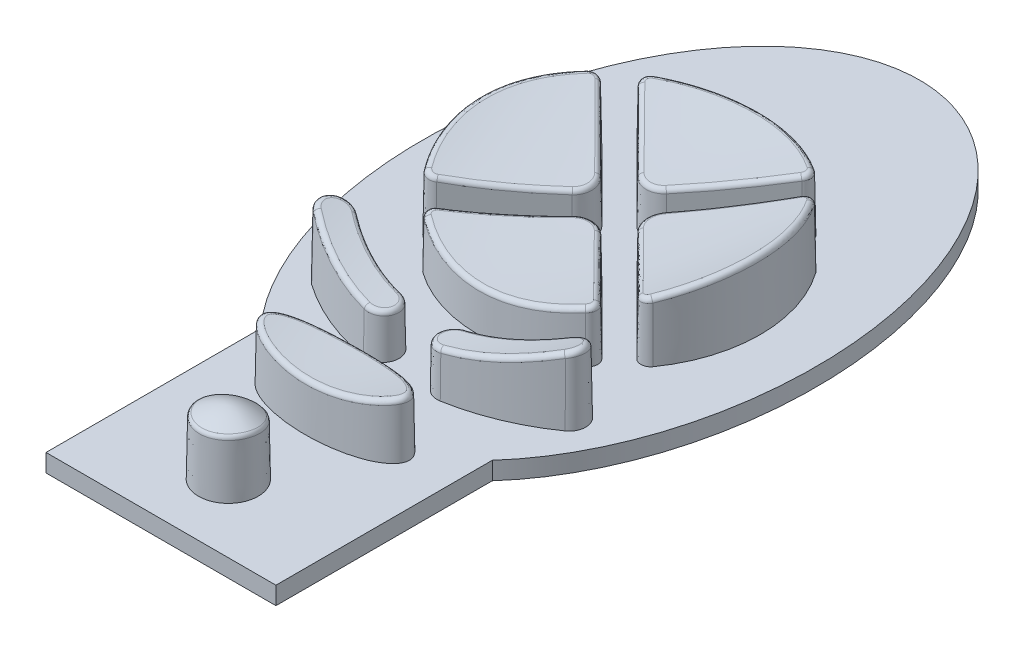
SolidWorks part; units mm, degrees
ref_plane "Front Plane" through (0, 0, 0) normal (0, 0, 1) x (1, 0, 0)
ref_plane "Top Plane" through (0, 0, 0) normal (0, 1, 0) x (1, 0, 0)
ref_plane "Right Plane" through (0, 0, 0) normal (1, 0, 0) x (0, 0, -1)
body saved out of another part "Stock-Remote_Control_Master-1"
